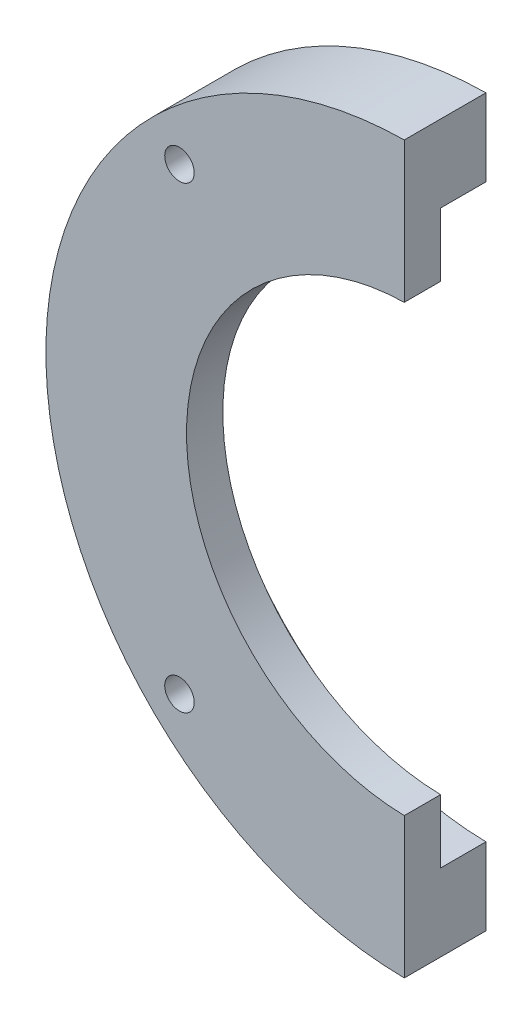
SolidWorks part; units mm, degrees
ref_plane "Plan1" through (0, 0, 0) normal (0, 0, 1) x (1, 0, 0)
ref_plane "Plan2" through (0, 0, 0) normal (0, 1, 0) x (1, 0, 0)
ref_plane "Plan3" through (0, 0, 0) normal (1, 0, 0) x (0, 0, -1)
sketch "Esquisse1" plane through (0, 0, 0) normal (0, 0, 1) x (1, 0, 0)
  line L0 (0, 0) -> (0, 111.3425) construction
  circle A0 centre (0, 0) radius 80
  dimension "D1" = 160
extrude "Base-Extrusion" add sketch "Esquisse1" along normal blind 18
sketch "Esquisse3" plane through (0, 0, 0) normal (0, 0, -1) x (-1, 0, 0)
  circle A0 centre (0, 0) radius 63
  dimension "D1" = 126
extrude "Enlèv. mat.-Extru.1" cut sketch "Esquisse3" against normal blind 10
sketch "Esquisse4" plane through (0, 0, 10) normal (0, 0, -1) x (-1, 0, 0)
  circle A0 centre (0, 0) radius 49
  dimension "D1" = 98
extrude "Enlèv. mat.-Extru.2" cut sketch "Esquisse4" against normal blind 8
other "Perçage1"
sketch "Esquisse6" plane through (0, 0, 18) normal (0, 0, 1) x (1, 0, 0)
  line L0 (0, 0) -> (-65.9867, -65.9867) construction
  circle A0 centre (-50.5581, -50.5581) radius 3.25
  dimension "D1" = 6.5
  dimension "D2" = 71.5
pattern_circular "Répétition circulaire1" count 2 every 90
sketch "Esquisse7" plane through (0, 0, 0) normal (0, 0, -1) x (-1, 0, 0)
  line L0 (0, 0) -> (0, 86.8117) construction
  line L1 (0, 0) -> (0, -87.6712) construction
  line L5 (1, -79.9937) -> (1, 79.9937)
  circle A0 centre (0, 0) radius 80 construction
  arc A1 (1, 79.9937) -> (1, -79.9937) centre (0, 0) ccw
  dimension "D1" = 1
extrude "Enlèv. mat.-Extru.4" cut sketch "Esquisse7" against normal through all
